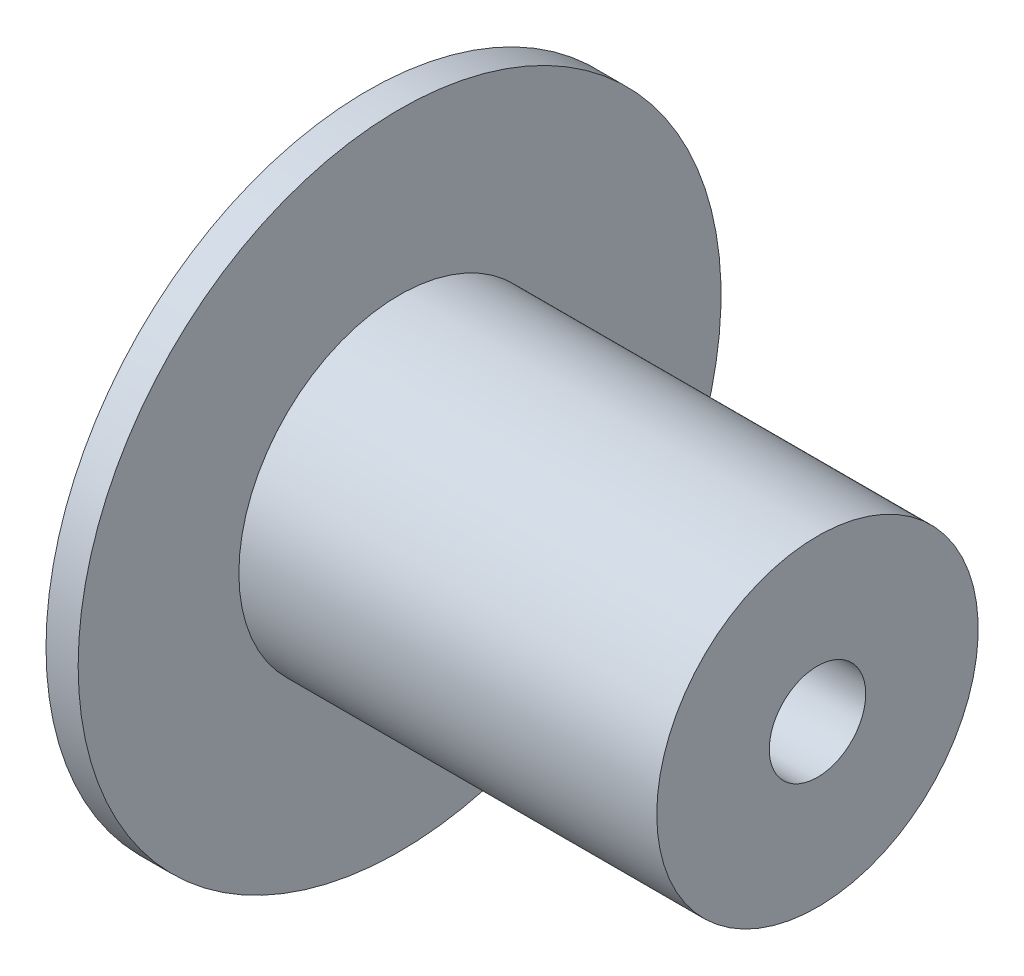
SolidWorks part; units mm, degrees
ref_plane "Front Plane" through (0, 0, 0) normal (0, 0, 1) x (1, 0, 0)
ref_plane "Top Plane" through (0, 0, 0) normal (0, 1, 0) x (1, 0, 0)
ref_plane "Right Plane" through (0, 0, 0) normal (1, 0, 0) x (0, 0, -1)
sketch "Sketch1" plane through (0, 0, 0) normal (0, 0, 1) x (1, 0, 0)
  line L0 (0, 0) -> (0, 10)
  line L1 (0, 10) -> (1, 10)
  line L2 (1, 10) -> (1, 5)
  line L3 (1, 5) -> (14, 5)
  line L4 (14, 5) -> (14, 0)
  line L5 (0, 0) -> (14, 0)
  dimension "D1" = 5
  dimension "D2" = 10
  dimension "D3" = 13
  dimension "D4" = 1
revolve "Revolve1" add sketch "Sketch1" angle 360 about L5
sketch "Sketch2" plane through (14, 0, 0) normal (1, 0, 0) x (0, 0, -1)
  circle A0 centre (0, 0) radius 1.5
  dimension "D1" = 3
extrude "Extrude1" cut sketch "Sketch2" against normal blind 10
